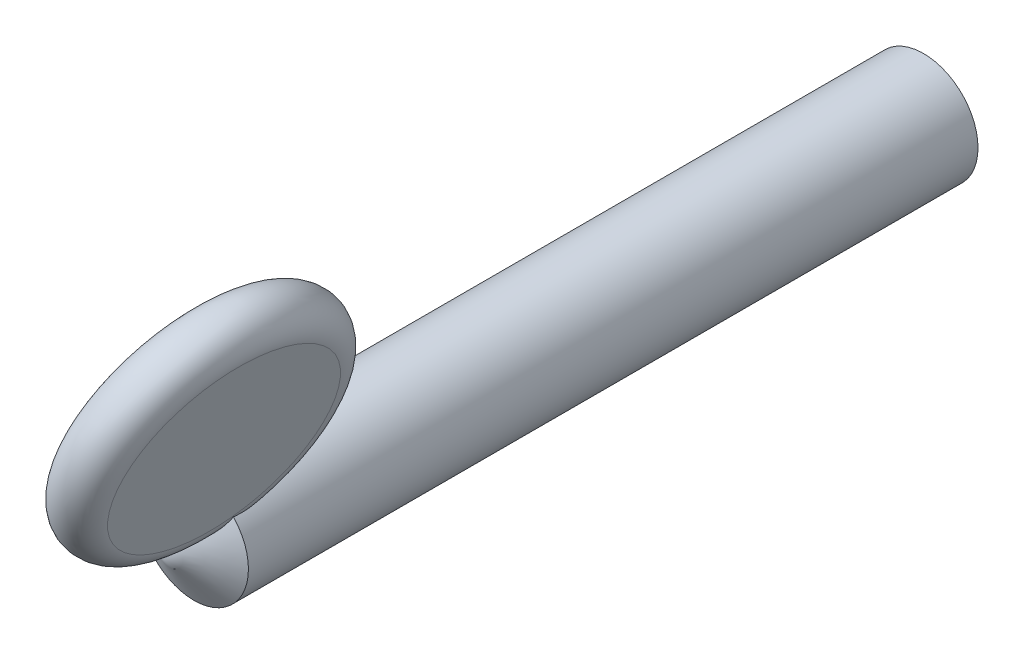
SolidWorks part; units mm, degrees
other "Tool Body"
other "Drill Body"
ref_plane "Front Plane" through (0, 0, 0) normal (0, 0, 1) x (1, 0, 0)
ref_plane "Top Plane" through (0, 0, 0) normal (0, 1, 0) x (1, 0, 0)
ref_plane "Right Plane" through (0, 0, 0) normal (1, 0, 0) x (0, 0, -1)
sketch "Sketch1" plane through (0, 0, 0) normal (1, 0, 0) x (0, 0, -1)
  line L0 (0, 0) -> (-140, 0)
  line L1 (-140, 0) -> (-133.9914, 10)
  line L2 (-133.9914, 10) -> (0, 10)
  line L3 (0, 10) -> (0, 0)
  line L4 (0, 0) -> (7.3997, 0) construction
  line L5 (-140, 0) -> (-133.9914, -10) construction
  dimension "D1" = 118
  dimension "D2" = 20
  dimension "D3" = 140
revolve "Revolve1" add sketch "Sketch1" angle 360 about L4
ref_plane "Plane1" through (0, 0, 140) normal (0, 0, 1) x (1, 0, 0)
sketch "Sketch2" plane through (0, 0, 140) normal (0, 0, 1) x (1, 0, 0)
  circle A0 centre (0, 0) radius 3
  dimension "D1" = 6
curve "Helix/Spiral1"
ref_plane "Plane2" through (0, 3, 140) normal (0.0894, 0, -0.996) x (-0.996, 0, -0.0894)
sketch "Sketch4" plane through (0, 3, 140) normal (0.0894, 0, -0.996) x (-0.996, 0, -0.0894)
  line L0 (0, 0) -> (-8, 22.6274) construction
  line L1 (-3.286, 24.2941) -> (3.0474, 6.3807)
  line L2 (-12.714, 20.9608) -> (-6.3807, 3.0474)
  line L3 (-3.286, 24.2941) -> (-12.714, 20.9608)
  arc A0 (3.0474, 6.3807) -> (-6.3807, 3.0474) centre (-1.6667, 4.714) cw
  dimension "D1" = 5
  dimension "D2" = 24
  dimension "D3" = 1
revolve "Revolve2" add sketch "Sketch4" angle 360 about L3
